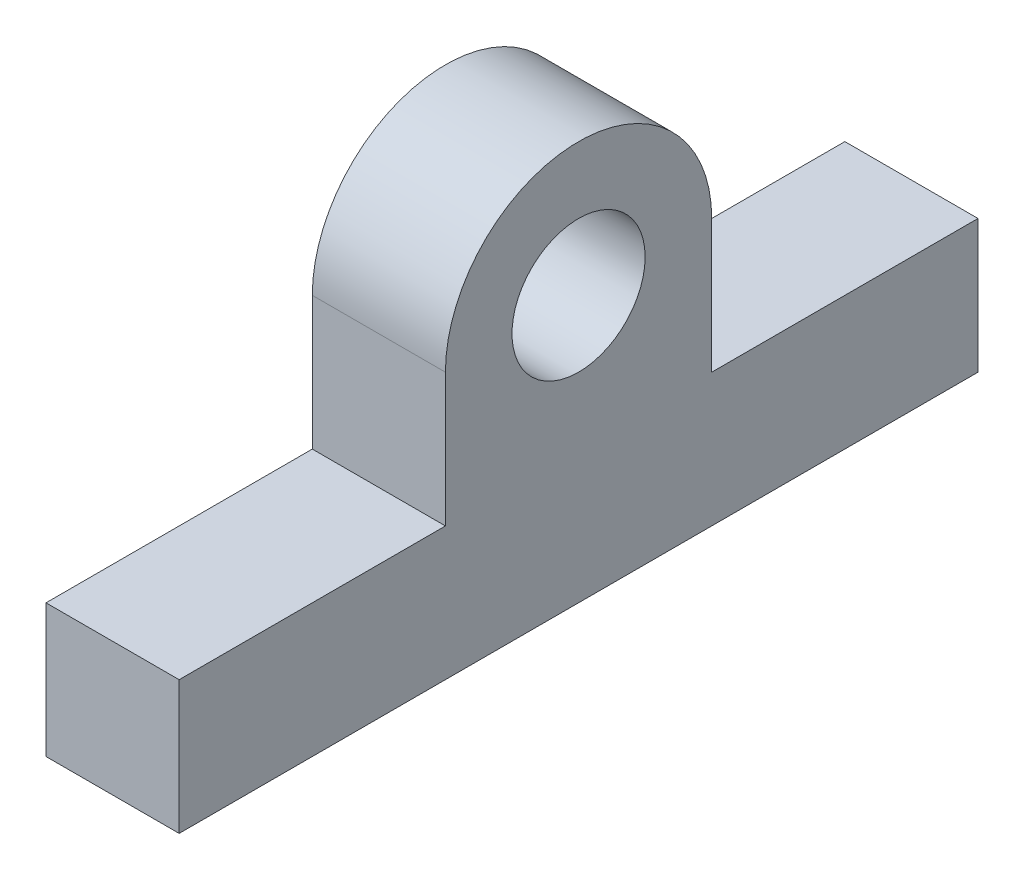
SolidWorks part; units mm, degrees
ref_plane "Front Plane" through (0, 0, 0) normal (0, 0, 1) x (1, 0, 0)
ref_plane "Top Plane" through (0, 0, 0) normal (0, 1, 0) x (1, 0, 0)
ref_plane "Right Plane" through (0, 0, 0) normal (1, 0, 0) x (0, 0, -1)
sketch "Sketch1" plane through (0, 0, 0) normal (1, 0, 0) x (0, 0, -1)
  line L0 (0, 0) -> (76.2, 0)
  line L1 (76.2, 0) -> (76.2, 12.7)
  line L2 (76.2, 12.7) -> (50.8, 12.7)
  line L3 (0, 12.7) -> (0, 0)
  line L5 (50.8, 12.7) -> (50.8, 25.4)
  line L7 (25.4, 25.4) -> (25.4, 12.7)
  line L9 (25.4, 12.7) -> (0, 12.7)
  arc A0 (50.8, 25.4) -> (25.4, 25.4) centre (38.1, 25.4) ccw
  dimension "D1" = 76.2
  dimension "D2" = 12.7
  dimension "D3" = 25.4
  dimension "D4" = 25.4
  dimension "D5" = 12.7
extrude "Boss-Extrude1" add sketch "Sketch1" along normal blind 12.7
sketch "Sketch2" plane through (12.7, 0, 0) normal (1, 0, 0) x (0, 0, -1)
  circle A0 centre (38.1, 25.4) radius 6.35
  dimension "D1" = 12.7
extrude "Cut-Extrude1" cut sketch "Sketch2" against normal through all
sketch "Sketch3" plane through (0, 0, 0) normal (0, -1, 0) x (1, 0, 0)
  line L0 (12.7, -76.2) -> (0, -76.2) construction
  line L3 (12.7, 0) -> (0, 0) construction
  circle A0 centre (6.35, -12.7) radius 1.27
  circle A1 centre (6.35, -63.5) radius 1.27
  point P4 (6.35, 0)
  point P7 (5.4332, -42.5446)
  point P10 (6.35, -76.2)
  point P11 (6.35, -67.3907)
  point P13 (10.0334, -75)
  point P14 (12.7, -61.8389)
  point P16 (7.766, -75)
  point P17 (29.7121, -49.2862)
  point P18 (2.5725, -67.8578)
  dimension "D1" = 2.54
  dimension "D4" = 2.54
  dimension "D6" = 12.7
  dimension "D2" = 0
  dimension "D3" = 12.7
  dimension "D5" = 0
  dimension "D7" = 50.8
extrude "Cut-Extrude2" cut sketch "Sketch3" against normal blind 6.35
equation "\"bearing_d\"= 0.5in"
equation "\"heat_set_d\"= 0.1in"
